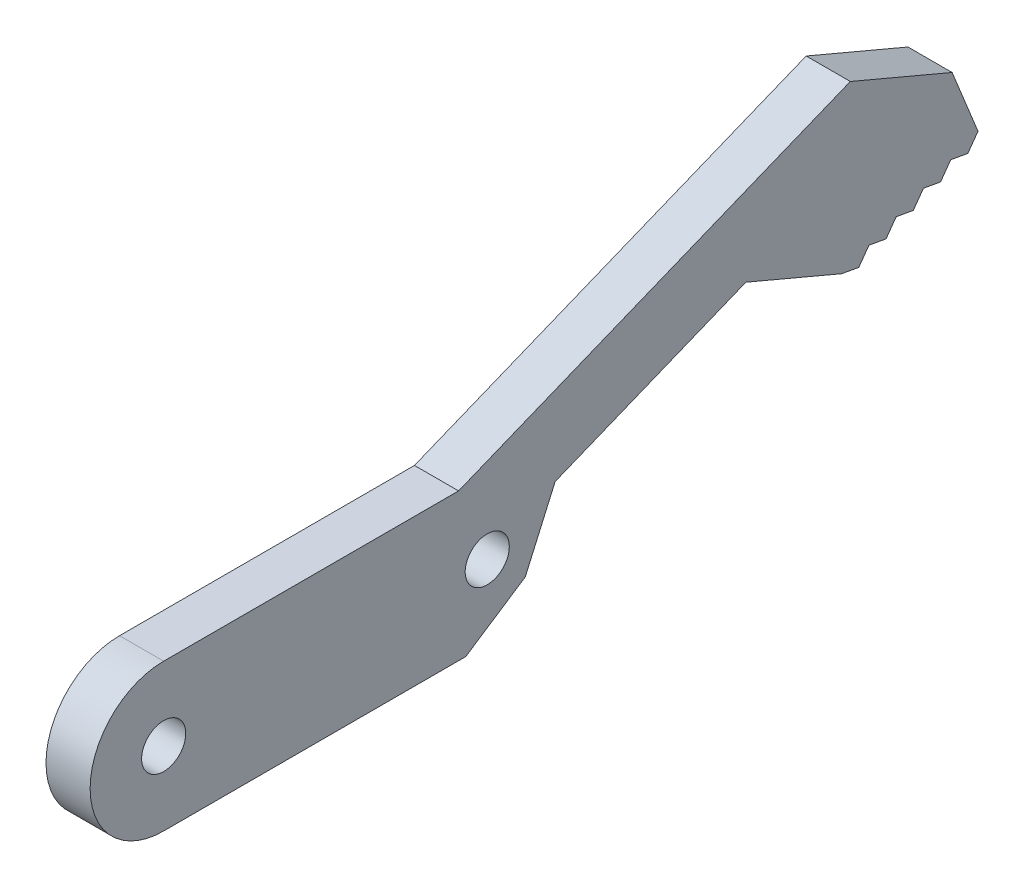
SolidWorks part; units mm, degrees
ref_plane "Front Plane" through (0, 0, 0) normal (0, 0, 1) x (1, 0, 0)
ref_plane "Top Plane" through (0, 0, 0) normal (0, 1, 0) x (1, 0, 0)
ref_plane "Right Plane" through (0, 0, 0) normal (1, 0, 0) x (0, 0, -1)
sketch "Sketch1" plane through (0, 0, 0) normal (1, 0, 0) x (0, 0, -1)
  line L1 (0, 0) -> (27, 0)
  line L2 (0, 0) -> (0, 10)
  line L3 (0, 10) -> (27, 10)
  circle A0 centre (5, 5) radius 1.5
  circle A1 centre (5, 5) radius 5
  circle A2 centre (27, 5) radius 5
  circle A3 centre (27, 5) radius 1.5
  dimension "D7" = 3
  dimension "D11" = 10
  dimension "D2" = 3
  dimension "D1" = 10
  dimension "D8" = 5
  dimension "D9" = 5
  dimension "D10" = 22
extrude "Boss-Extrude1" add sketch "Sketch1" along normal blind 3 contours A1 A0 | A2 L3 A1 L1 | A2 A3
sketch "Sketch2" plane through (3, 0, 0) normal (1, 0, 0) x (0, 0, -1)
  line L0 (27, 0) -> (60.3654, 13.5185)
  line L1 (5, 0) -> (27, 0) construction
  line L3 (60.3654, 13.5185) -> (56.6103, 22.7866)
  line L5 (56.6103, 22.7866) -> (25.0511, 10)
  line L6 (5, 10) -> (27, 10) construction
  line L7 (31.6102, 7.2627) -> (44.5856, 12.5199)
  line L8 (31.6102, 7.2627) -> (28.8536, 0.751)
  line L9 (44.5856, 12.5199) -> (51.0972, 9.7633)
  line L10 (51.0972, 9.7633) -> (60.3654, 13.5185)
  line L11 (51.0972, 9.7633) -> (51.3338, 9.1794)
  line L12 (60.3654, 13.5185) -> (60.602, 12.9346)
  line L13 (51.3338, 9.1794) -> (60.602, 12.9346)
  line L14 (5, 10) -> (27, 10)
  arc A3 (27, 0) -> (27, 10) centre (27, 5) ccw construction
  arc A4 (27, 0) -> (27, 10) centre (27, 5) ccw
  dimension "D1" = 157.944
  dimension "D2" = 36
  dimension "D3" = 90
  dimension "D4" = 10
  dimension "D5" = 10
  dimension "D6" = 45
  dimension "D7" = 45
  dimension "D8" = 5
  dimension "D9" = 5
  dimension "D10" = 14
  dimension "D11" = 0.63
extrude "Boss-Extrude2" add sketch "Sketch2" against normal blind 3 contours L7 L9 L0 L3 L5 L8 M1 M4 | L11 L13 L12 L0
sketch "Sketch4" plane through (3, 0, 0) normal (1, 0, 0) x (0, 0, -1)
  line L0 (51.6843, 20.7908) -> (58.6061, 17.8606)
  line L1 (56.6103, 22.7866) -> (25.0511, 10) construction
  line L2 (60.602, 12.9346) -> (56.6103, 22.7866) construction
  line L3 (44.5856, 12.5199) -> (51.0972, 9.7633) construction
  line L4 (56.6103, 22.7866) -> (25.0511, 10)
  line L5 (60.602, 12.9346) -> (56.6103, 22.7866)
extrude "Cut-Extrude2" cut sketch "Sketch4" against normal through all contours L0 M9 M8
sketch "Croquis1"
  dimension "D1" = 2
extrude "Cortar-Extruir1" cut sketch "Croquis1" against normal up to next
